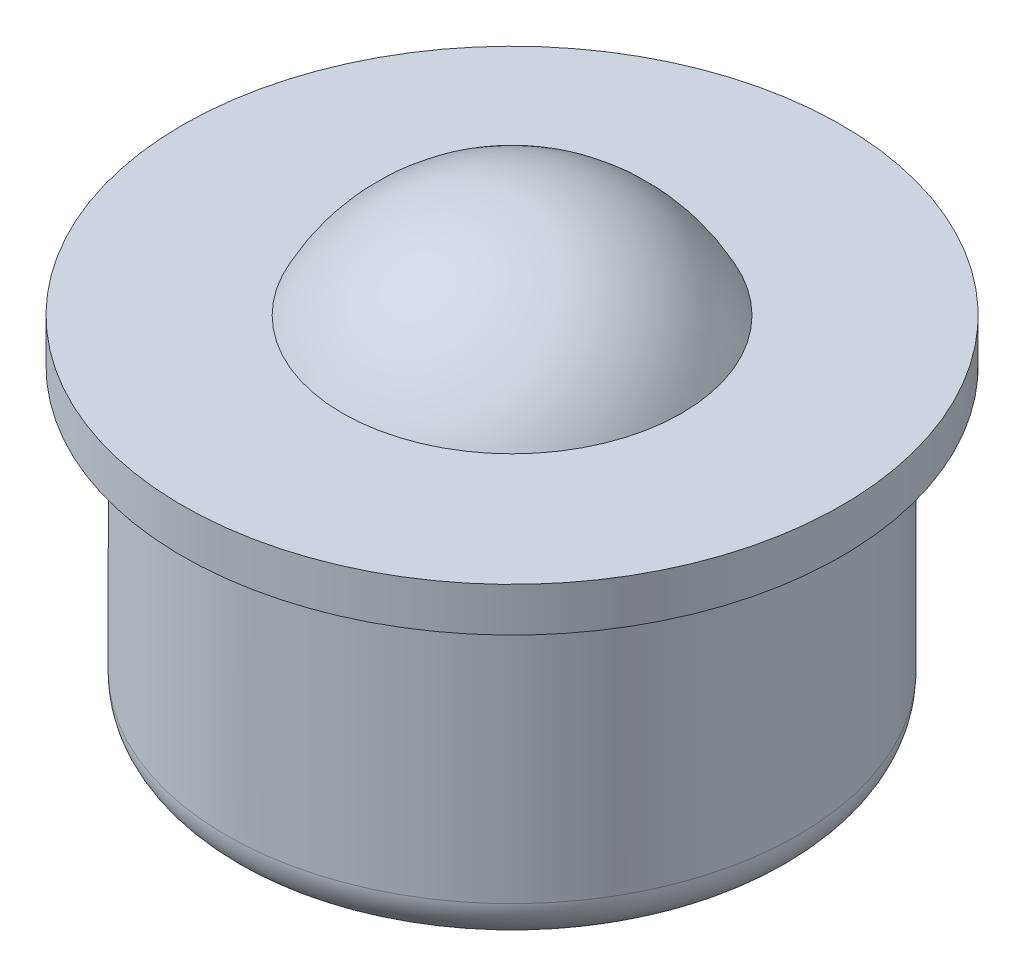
SolidWorks part; units mm, degrees
ref_plane "前视基准面" through (0, 0, 0) normal (0, 0, 1) x (1, 0, 0)
ref_plane "上视基准面" through (0, 0, 0) normal (0, 1, 0) x (1, 0, 0)
ref_plane "右视基准面" through (0, 0, 0) normal (1, 0, 0) x (0, 0, -1)
sketch "草图1" plane through (0, 0, 0) normal (0, 0, 1) x (1, 0, 0)
  line L0 (-59.7207, 0) -> (58.9155, 0) construction
  line L1 (0, 57.0366) -> (0, -56.7682) construction
  line L2 (-5.5, -7) -> (0, -7)
  line L3 (-6.5, 0) -> (-6.5, -6)
  line L4 (-6.5, 0) -> (0, 0)
  line L5 (0, -7) -> (0, 0)
  arc A0 (-5.5, -7) -> (-6.5, -6) centre (-5.5, -6) cw
  point P8 (0, -7)
  point P11 (-3.25, 0)
  dimension "D1" = 1
  dimension "D2" = 7
  dimension "D3" = 6.5
revolve "旋转2" add sketch "草图1" angle 360 about L5
sketch "草图2" plane through (0, 0, 0) normal (0, 1, 0) x (1, 0, 0)
  circle A0 centre (0, 0) radius 7.5
extrude "凸台-拉伸1" add sketch "草图2" along normal blind 1
sketch "滚球" plane through (0, 0, 0) normal (1, 0, 0) x (0, 0, -1)
  line L0 (0, 6.7011) -> (0, -10.1149) construction
  line L2 (0, 3.3821) -> (0, 0.9821)
  line L3 (0, 0.9821) -> (0, -5.2579)
  arc A0 (0, 3.3821) -> (0, -5.2579) centre (0, -0.9379) cw
  point P5 (0, 0)
  point P6 (0, -10.1149)
  point P9 (17.8628, 5.6161)
  dimension "D1" = 8.64
  dimension "D2" = 2.4
revolve "旋转" add sketch "滚球" angle 360 about L2
